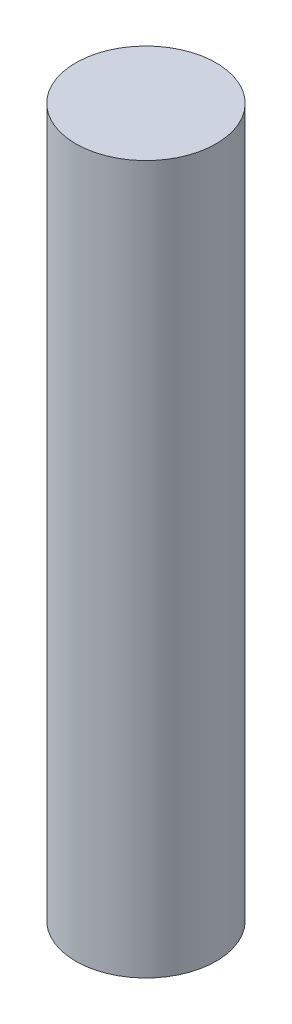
SolidWorks part; units mm, degrees
ref_plane "Front Plane" through (0, 0, 0) normal (0, 0, 1) x (1, 0, 0)
ref_plane "Top Plane" through (0, 0, 0) normal (0, 1, 0) x (1, 0, 0)
ref_plane "Right Plane" through (0, 0, 0) normal (1, 0, 0) x (0, 0, -1)
sketch "Sketch1" plane through (0, 0, 0) normal (0, 1, 0) x (1, 0, 0)
  circle A0 centre (0, 0) radius 0.58
  dimension "D1" = 1.16
extrude "Boss-Extrude1" add sketch "Sketch1" along normal blind 5.85
